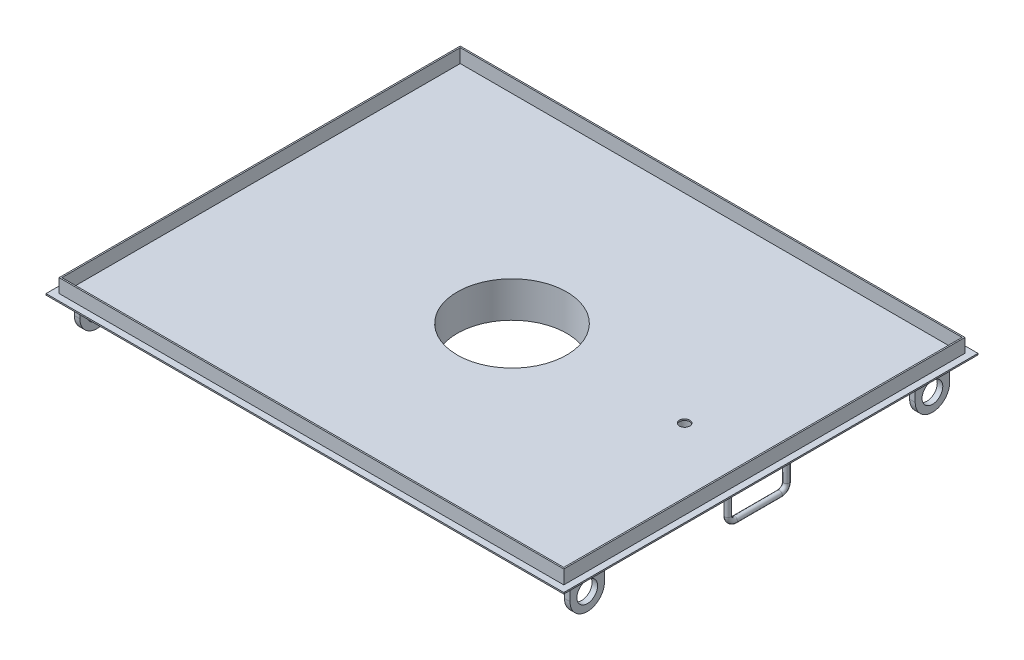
SolidWorks part; units mm, degrees
ref_plane "Front Plane" through (0, 0, 0) normal (0, 0, 1) x (1, 0, 0)
ref_plane "Top Plane" through (0, 0, 0) normal (0, 1, 0) x (1, 0, 0)
ref_plane "Right Plane" through (0, 0, 0) normal (1, 0, 0) x (0, 0, -1)
sketch "Sketch1" plane through (0, 0, 0) normal (0, 1, 0) x (1, 0, 0)
  line L1 (-750, -600) -> (750, -600)
  line L2 (-750, -600) -> (-750, 600)
  line L3 (-750, 600) -> (750, 600)
  line L4 (750, -600) -> (750, 600)
  line L5 (-750, -600) -> (750, 600) construction
  line L6 (-750, 600) -> (750, -600) construction
  circle A0 centre (0, 0) radius 162.5
  point P0 (0, 0)
  dimension "D3" = 325
  dimension "D1" = 1200
  dimension "D2" = 1500
extrude "Boss-Extrude1" add sketch "Sketch1" along normal blind 4
sketch "Sketch2" plane through (0, 4, 0) normal (0, 1, 0) x (1, 0, 0)
  line L1 (-731, -581) -> (731, -581)
  line L2 (-731, -581) -> (-731, 581)
  line L3 (-731, 581) -> (731, 581)
  line L4 (731, -581) -> (731, 581)
  line L5 (-731, -581) -> (731, 581) construction
  line L6 (-731, 581) -> (731, -581) construction
  line L8 (727, -577) -> (727, 577)
  line L9 (-727, 577) -> (727, 577)
  line L10 (-727, -577) -> (-727, 577)
  line L11 (-727, -577) -> (727, -577)
  point P0 (0, 0)
  dimension "D1" = 1462
  dimension "D2" = 1162
  dimension "D3" = 4
extrude "Boss-Extrude2" add sketch "Sketch2" along normal blind 40
sketch "Sketch3" plane through (0, 4, 0) normal (0, 1, 0) x (1, 0, 0)
  circle A0 centre (0, 0) radius 162.5
  circle A1 centre (0, 0) radius 162.5 construction
  circle A2 centre (0, 0) radius 158.5
  dimension "D1" = 4
extrude "Boss-Extrude3" add sketch "Sketch3" against normal blind 104
sketch "Sketch4" plane through (0, -100, 0) normal (0, -1, 0) x (1, 0, 0)
  circle A0 centre (0, 0) radius 202.5
  circle A1 centre (0, 0) radius 162.5
  circle A2 centre (0, 0) radius 162.5 construction
  dimension "D1" = 405
extrude "Boss-Extrude4" add sketch "Sketch4" against normal blind 4
sketch "Sketch5" plane through (0, 0, 0) normal (0, -1, 0) x (1, 0, 0)
  line L0 (0, 0) -> (500, 0) construction
  circle A0 centre (500, 0) radius 35
  circle A1 centre (500, 0) radius 24
  dimension "D1" = 70
  dimension "D2" = 48
  dimension "D3" = 500
extrude "Boss-Extrude5" add sketch "Sketch5" along normal blind 26
sketch "Sketch6" plane through (0, 0, 0) normal (0, -1, 0) x (1, 0, 0)
  circle A0 centre (500, 0) radius 15
  dimension "D1" = 30
extrude "Cut-Extrude1" cut sketch "Sketch6" against normal through all
ref_plane "Plane2" through (710, 0, 0) normal (1, 0, 0) x (0, 0, -1)
sketch "Sketch7" plane through (0, 0, 0) normal (0, -1, 0) x (1, 0, 0)
  line L0 (0, 0) -> (-500, 0) construction
  circle A0 centre (-500, 0) radius 128
  dimension "D1" = 256
  dimension "D2" = 500
extrude "Boss-Extrude6" add sketch "Sketch7" along normal blind 57
sketch "Sketch8" plane through (0, 0, 0) normal (0, 0, 1) x (1, 0, 0)
  line L0 (-575, -57) -> (-575, -126)
  line L1 (-628, -57) -> (-372, -57) construction
  line L2 (-555, -146) -> (-445, -146)
  line L3 (-425, -126) -> (-425, -57)
  line L4 (-500, -146) -> (-500, -57) construction
  arc A0 (-575, -126) -> (-555, -146) centre (-555, -126) ccw
  arc A1 (-445, -146) -> (-425, -126) centre (-445, -126) ccw
  point P10 (-575, -146)
  point P13 (-425, -146)
  dimension "D3" = 20
  dimension "D1" = 150
  dimension "D2" = 89
sketch "Sketch9" plane through (0, -57, 0) normal (0, -1, 0) x (1, 0, 0)
  circle A0 centre (-425, 0) radius 9
  dimension "D1" = 18
sweep "Sweep1" add profiles "Sketch9" path "Sketch8"
sketch "Sketch10" plane through (0, 0, 0) normal (0, 0, 1) x (1, 0, 0)
  line L0 (-372, -57) -> (-372, 0) construction
  line L1 (-361, -44) -> (-372, -44)
  line L2 (-372, -33) -> (-372, -24)
  line L3 (-361, -24) -> (-372, -24)
  line L4 (-372, -44) -> (-372, -35)
  line L5 (-370.5, -25.5) -> (-372, -24) construction
  line L6 (-361, -33) -> (-372, -44) construction
  line L7 (-750, 0) -> (750, 0) construction
  line L8 (-500, -57) -> (-500, 0) construction
  line L9 (-628, -57) -> (-372, -57) construction
  line L10 (-628, 0) -> (-372, 0) construction
  line L11 (-352, -33) -> (-372, -33)
  line L12 (-352, -35) -> (-372, -35)
  arc A0 (-361, -44) -> (-352, -35) centre (-361, -35) ccw
  arc A1 (-352, -33) -> (-361, -24) centre (-361, -33) ccw
  point P0 (-362, -34)
  dimension "D4" = 9
  dimension "D6" = 11
  dimension "D1" = 34
  dimension "D2" = 20
  dimension "D3" = 129.5
  dimension "D5" = 2
  dimension "D7" = 13
sweep "Sweep2" add profiles "Sketch10"
sketch "Sketch11" plane through (0, -57, 0) normal (0, -1, 0) x (1, 0, 0)
  line L0 (-540, -121.5895) -> (-540, -175)
  line L1 (-540, -175) -> (-460, -175)
  line L2 (-460, -175) -> (-460, -121.5895)
  line L3 (-372, 0) -> (-361, 0) construction
  line L4 (-500, 0) -> (-500, -175) construction
  arc A0 (-372, 0) -> (-500, -128) centre (-500, 0) ccw construction
  arc A1 (-500, -128) -> (-372, 0) centre (-500, 0) ccw construction
  arc A2 (-540, -121.5895) -> (-460, -121.5895) centre (-500, 0) ccw
  dimension "D1" = 175
  dimension "D2" = 80
extrude "Boss-Extrude7" add sketch "Sketch11" against normal up to surface (33 mm away)
sketch "Sketch12" plane through (0, -57, 0) normal (0, -1, 0) x (1, 0, 0)
  line L0 (-500, 148) -> (-500, 0) construction
  line L1 (-525, 133) -> (-501.5, 133)
  line L2 (-525, 133) -> (-525, 163)
  line L3 (-525, 163) -> (-501.5, 163)
  line L4 (-475, 133) -> (-475, 163)
  line L5 (-525, 133) -> (-475, 163) construction
  line L6 (-525, 163) -> (-475, 133) construction
  line L7 (-498.5, 163) -> (-498.5, 133)
  line L8 (-501.5, 163) -> (-501.5, 133)
  line L9 (-498.5, 148) -> (-501.5, 148) construction
  line L10 (-498.5, 163) -> (-475, 163)
  line L11 (-498.5, 133) -> (-475, 133)
  arc A0 (-352, 0) -> (-540, -142.4921) centre (-500, 0) ccw construction
  point P0 (-500, 148)
  dimension "D1" = 30
  dimension "D2" = 50
  dimension "D3" = 3
extrude "Boss-Extrude8" add sketch "Sketch12" against normal blind 50 separate body
ref_plane "Plane1" through (0, -32, 0) normal (0, -1, 0) x (-1, 0, 0)
sketch "Sketch15" plane through (0, -32, 0) normal (0, -1, 0) x (-1, 0, 0)
  line L0 (475, -148) -> (533.0202, -148)
  line L1 (475, -133) -> (475, -163) construction
  line L3 (533.0202, -148) -> (555, -140)
  line L4 (555, -140) -> (555, -153)
  line L5 (555, -153) -> (475, -153)
  line L6 (475, -153) -> (475, -148)
  line L7 (475, -163) -> (498.5, -163) construction
  dimension "D1" = 5
  dimension "D2" = 13
  dimension "D3" = 20
  dimension "D4" = 80
  dimension "D5" = 10
revolve "Revolve1" add sketch "Sketch15" angle 360 about L5
sketch "Sketch17" plane through (710, 0, 0) normal (1, 0, 0) x (0, 0, -1)
  line L0 (-600, 0) -> (600, 0) construction
  line L1 (550, 0) -> (450, 0)
  line L2 (550, 0) -> (550, -60)
  line L4 (450, 0) -> (450, -60)
  circle A0 centre (500, -60) radius 30
  arc A1 (450, -60) -> (550, -60) centre (500, -60) ccw
  dimension "D1" = 60
  dimension "D2" = 60
  dimension "D3" = 50
  dimension "D4" = 100
  dimension "D5" = 100
extrude "Boss-Extrude9" add sketch "Sketch17" against normal mid plane 16
mirror "Mirror1" about plane through (0, 0, 0) normal (1, 0, 0) of "Boss-Extrude9"
mirror "Mirror2" about plane through (0, 0, 0) normal (0, 0, 1) of "Mirror1", "Boss-Extrude9"
sketch "Sketch20" plane through (710, 0, 0) normal (-1, 0, 0) x (0, 0, 1)
  line L0 (-85, 0) -> (-85, -80)
  line L1 (-128, 0) -> (128, 0) construction
  line L2 (-65, -100) -> (65, -100)
  line L3 (85, -80) -> (85, 0)
  line L4 (0, 0) -> (0, -100) construction
  arc A0 (65, -100) -> (85, -80) centre (65, -80) ccw
  arc A1 (-85, -80) -> (-65, -100) centre (-65, -80) ccw
  point P11 (85, -100)
  point P14 (-85, -100)
  dimension "D3" = 20
  dimension "D1" = 100
  dimension "D2" = 170
sketch "Sketch21" plane through (0, 0, 0) normal (0, -1, 0) x (1, 0, 0)
  circle A0 centre (710, 85) radius 8
  dimension "D1" = 16
sweep "Sweep3" add profiles "Sketch21" path "Sketch20"
mirror "Mirror3" about plane through (0, 0, 0) normal (1, 0, 0) of "Sweep3"
